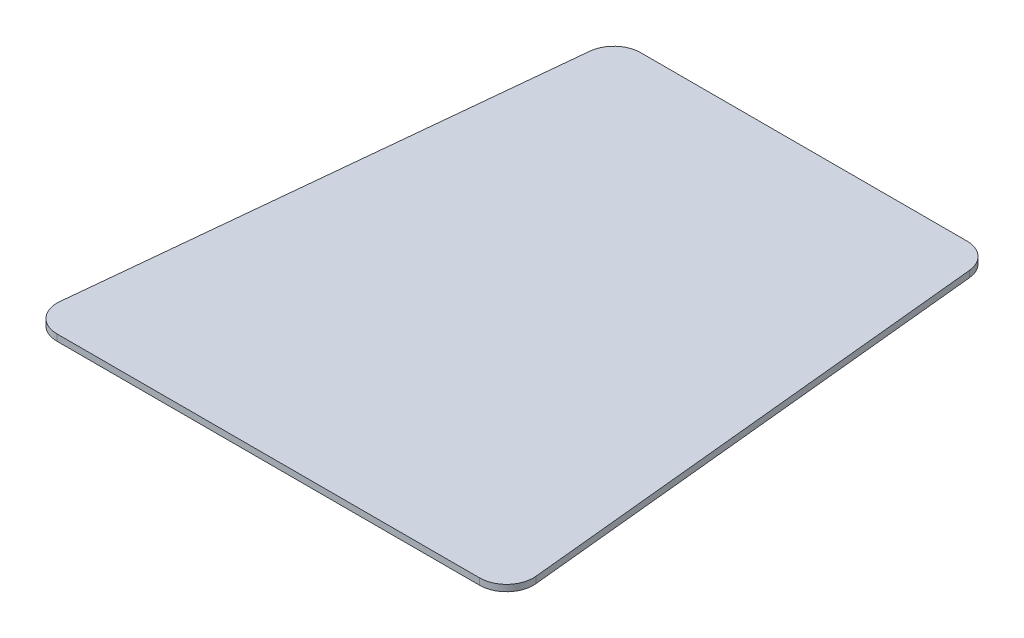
SolidWorks part; units mm, degrees
ref_plane "Front Plane" through (0, 0, 0) normal (0, 0, 1) x (1, 0, 0)
ref_plane "Top Plane" through (0, 0, 0) normal (0, 1, 0) x (1, 0, 0)
ref_plane "Right Plane" through (0, 0, 0) normal (1, 0, 0) x (0, 0, -1)
sketch "Sketch1" plane through (0, 0, 0) normal (0, 1, 0) x (1, 0, 0)
  line L0 (0, 0) -> (0, -118.715) construction
  line L1 (38.7033, 0) -> (-38.7033, 0)
  line L2 (-45.0218, -5.7182) -> (-56.4518, -120.0182)
  line L3 (-50.1333, -127) -> (50.1333, -127)
  line L4 (45.0218, -5.7182) -> (56.4518, -120.0182)
  arc A0 (-38.7033, 0) -> (-45.0218, -5.7182) centre (-38.7033, -6.35) ccw
  arc A1 (45.0218, -5.7182) -> (38.7033, 0) centre (38.7033, -6.35) ccw
  arc A2 (-56.4518, -120.0182) -> (-50.1333, -127) centre (-50.1333, -120.65) ccw
  arc A3 (56.4518, -120.0182) -> (50.1333, -127) centre (50.1333, -120.65) cw
  point P7 (0, -127)
  point P10 (-44.45, 0)
  point P13 (44.45, 0)
  point P16 (-57.15, -127)
  point P19 (57.15, -127)
  dimension "D4" = 6.35
  dimension "D1" = 88.9
  dimension "D2" = 114.3
  dimension "D3" = 127
extrude "Extrude1" add sketch "Sketch1" along normal blind 1.524
